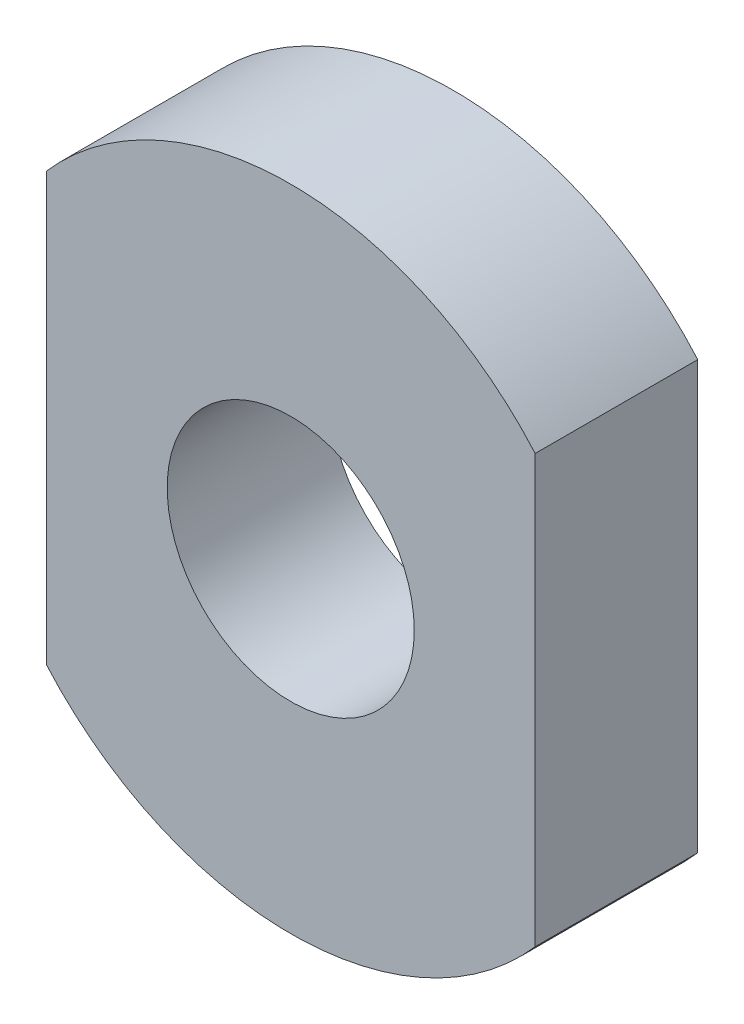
SolidWorks part; units mm, degrees
ref_plane "Plane1" through (0, 0, 0) normal (0, 0, 1) x (1, 0, 0)
ref_plane "Plane2" through (0, 0, 0) normal (0, 1, 0) x (1, 0, 0)
ref_plane "Plane3" through (0, 0, 0) normal (1, 0, 0) x (0, 0, -1)
sketch "Sketch1" plane through (0, 0, 0) normal (0, 0, 1) x (1, 0, 0)
  line L0 (4.7752, 4.1718) -> (4.7752, -4.1718)
  line L1 (-4.7752, 4.1718) -> (-4.7752, -4.1718)
  arc A0 (4.7752, 4.1718) -> (-4.7752, 4.1718) centre (0, 0) ccw
  circle A1 centre (0, 0) radius 2.413
  arc A2 (-4.7752, -4.1718) -> (4.7752, -4.1718) centre (0, 0) ccw
  dimension "D1" = 6.3409
  dimension "D2" = 4.826
  dimension "D3" = 4.7752
  dimension "D4" = 4.7752
extrude "Base-Extrude" add sketch "Sketch1" along normal blind 3.175
